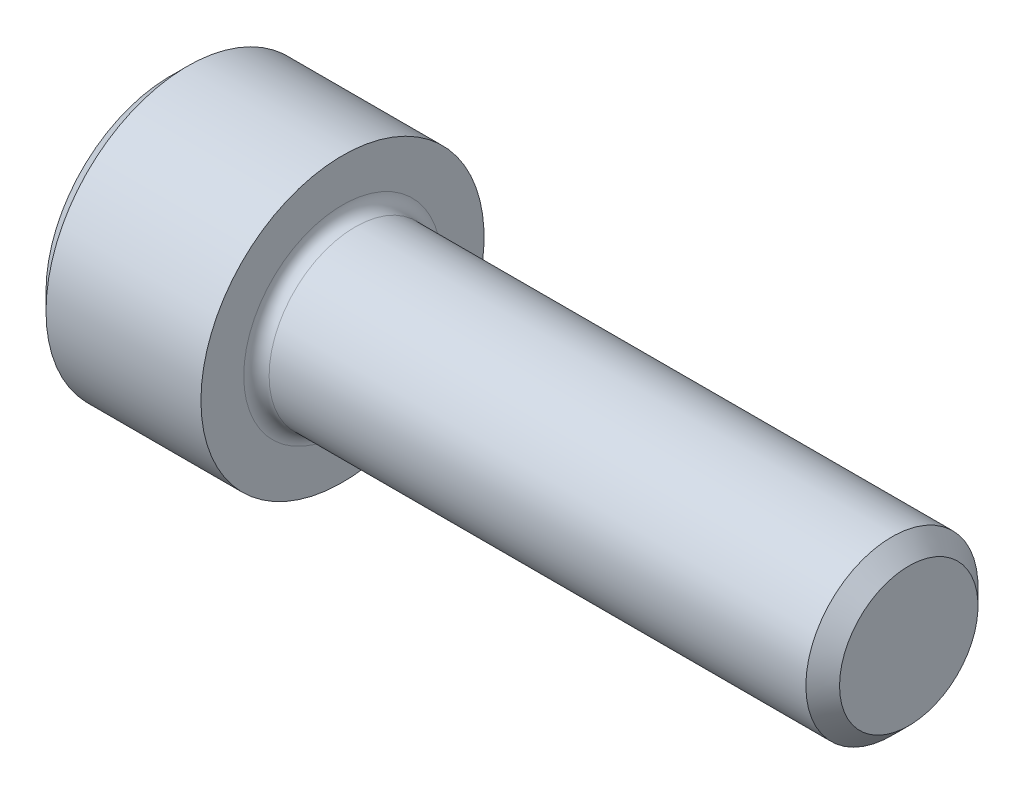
SolidWorks part; units mm, degrees
ref_plane "Plane1" through (0, 0, 0) normal (0, 0, 1) x (1, 0, 0)
ref_plane "Plane2" through (0, 0, 0) normal (0, 1, 0) x (1, 0, 0)
ref_plane "Plane3" through (0, 0, 0) normal (1, 0, 0) x (0, 0, -1)
revolve "Base-Revolve" add sketch "BodySke"
sketch "BodySke" plane through (0, 0, 0) normal (0, 0, 1) x (1, 0, 0)
  line L0 (0, 0) -> (0, 3.4862)
  line L1 (0.4826, 3.9687) -> (4.826, 3.9687)
  line L2 (4.826, 3.9687) -> (4.826, 2.413)
  line L3 (4.826, 2.413) -> (20.2286, 2.413)
  line L4 (20.701, 1.9406) -> (20.701, 0)
  line L5 (20.701, 0) -> (0, 0)
  line L6 (-31.75, 0) -> (127, 0) construction
  line L7 (0, 3.4862) -> (0.4826, 3.9687)
  line L8 (20.701, 1.9406) -> (20.2286, 2.413)
  line L9 (0, -3.4862) -> (0.4826, -3.9688) construction
  line L10 (20.701, -1.9406) -> (20.2286, -2.413) construction
  line L11 (5.6185, 9.525) -> (5.6185, 3.175) construction
  line L12 (4.826, 9.525) -> (4.826, 3.175) construction
  line L13 (-17.399, 9.525) -> (-17.399, 3.175) construction
  dimension "Diameter" = 4.826
  dimension "Head_ht" = 4.826
  dimension "Length" = 15.875
  dimension "Body_ch_ang" = 45
  dimension "Head_dia" = 7.9375
  dimension "Head_ch_ang" = 45
  dimension "Head_side_ht" = 4.3434
  dimension "Minor_dia" = 3.8811
  dimension "Advance" = 0.7925
  dimension "Thread_nom" = 15.875
  dimension "Thread_length" = 38.1
fillet "Fillet1" radius 0.3556 1 edges at (4.826, 0, 2.413)
sketch "Sketch2" plane through (0, 0, 0) normal (0, 0, 1) x (1, 0, 0)
  line L0 (0, 1.985) -> (2.286, 1.985)
  line L1 (2.286, 1.985) -> (3.432, 0)
  line L2 (-31.75, 0) -> (127, 0) construction
  line L3 (3.432, 0) -> (0, 0)
  line L4 (0, 0) -> (0, 1.985)
  line L5 (0, 3.4862) -> (0, -3.4862) construction
  line L6 (0, 0) -> (47.625, 0) construction
  line L7 (4.826, -3.9687) -> (4.826, 3.9687) construction
  dimension "D1" = 1.985
  dimension "D2" = 60
  dimension "Wall_thickness" = 2.54
revolve "Hex-PreBroach" cut sketch "Sketch2" angle 360 about L6
sketch "Sketch3" plane through (0, 0, 0) normal (-1, 0, 0) x (0, 0.5, 0.866)
  line L0 (1.146, 1.985) -> (-1.146, 1.985)
  line L1 (-1.146, 1.985) -> (-2.2921, 0)
  line L2 (1.146, 1.985) -> (2.2921, 0)
  line L3 (1.146, -1.985) -> (2.2921, 0)
  line L4 (1.146, -1.985) -> (-1.146, -1.985)
  line L5 (-1.146, -1.985) -> (-2.2921, 0)
  dimension "D1" = 1.985
  dimension "D2" = 1.985
  dimension "Hex_size" = 3.97
extrude "Hex" cut sketch "Sketch3" against normal blind 2.286
sketch "Sketch4" plane through (0, 0, 0) normal (-1, 0, 0) x (0, 0, 1)
  line L0 (0, 0) -> (2.3876, 0)
  line L1 (0, 0) -> (6.1484, 3.5498) construction
  line L2 (0, 0) -> (1.1938, 2.0677)
  line L3 (1.9883, 0.576) -> (2.2704, 0.7389)
  line L4 (1.493, 1.4339) -> (1.7751, 1.5968)
  arc A0 (1.9883, 0.576) -> (1.493, 1.4339) centre (0, 0) ccw
  arc A1 (2.3876, 0) -> (2.2704, 0.7389) centre (0, 0) ccw
  arc A2 (1.1938, 2.0677) -> (1.7751, 1.5968) centre (0, 0) cw
  dimension "D1" = 30
  dimension "Spline_n_dim" = 4.1402
  dimension "Spline_m_dim" = 4.7752
  dimension "D2" = 60
  dimension "D3" = 0.4953
  dimension "Spline_p_dim" = 0.9906
extrude "Spline" [suppressed] cut sketch "Sketch4" against normal blind 2.286
pattern_circular "CirPattern1" [suppressed] count 6 every 60
sketch "Sketch5" plane through (0, 0, 0) normal (0, 0, 1) x (1, 0, 0)
  line L0 (-31.75, 0) -> (127, 0) construction
  line L2 (0, 3.4862) -> (0, -3.4862) construction
  circle A0 centre (1.651, 0) radius 0.5905
  dimension "Drilled_hole_dia" = 1.1811
  dimension "Drilled_hole_loc" = 1.651
extrude "Hole" [suppressed] cut sketch "Sketch5" against normal through all and the other way through all
pattern_circular "Drilled-4" [suppressed] count 2 every 60
pattern_circular "Drilled-6" [suppressed] count 3 every 60
sketch "ThdSchSke" plane through (0, 0, 0) normal (0, 0, 1) x (1, 0, 0)
  line L0 (5.6185, -1.9406) -> (5.2877, -2.413)
  line L1 (5.6185, -1.9406) -> (5.9493, -2.413)
  line L2 (5.9493, -2.413) -> (5.9493, -3.0163)
  line L3 (-3.175, 0) -> (5.1513, 0) construction
  line L5 (5.9493, -3.0163) -> (5.2877, -3.0163)
  line L6 (5.2877, -3.0163) -> (5.2877, -2.413)
  line L7 (0, 3.4862) -> (0, -3.4862) construction
  dimension "Thread_minor" = 3.8811
  dimension "Diameter" = 4.826
  dimension "Start" = 5.6185
  dimension "SideAngle" = 55
  dimension "VeeAngle" = 70
  dimension "Overcut" = 6.0325
revolve "ThreadSchematic" [suppressed] cut sketch "ThdSchSke" angle 360 about L3
pattern_linear "ThdSchPat" [suppressed]
equation "\"D2@Sketch3\" = \"Hex_size@Sketch3\" / 2"
equation "\"D1@Sketch3\" = \"Hex_size@Sketch3\" / 2"
equation "\"D1@Sketch2\" = \"Hex_size@Sketch3\" / 2"
equation "\"D3@Sketch4\" = \"Spline_p_dim@Sketch4\" / 2"
equation "\"Thread_minor@ThreadCosmetic\"  =  \"Minor_dia@BodySke\""
equation "\"D2@CirPattern1\" = 360 / \"Num_teeth@CirPattern1\""
equation "\"Wall_thickness@Sketch2\" = \"Head_ht@BodySke\" - \"Key_eng@Hex\""
equation "\"Thread_length@ThreadCosmetic\" = ((sgn( (\"Length@BodySke\" - \"Advance@BodySke\" ) - \"Thread_nom@BodySke\" )-1)*( (\"Length@BodySke\" - \"Advance@BodySke\" ) - \"Thread_nom@BodySke\" ))/-2+ \"Thread_nom@BodySke\""
equation "\"Thread_minor@ThdSchSke\" = \"Minor_dia@BodySke\""
equation "\"Diameter@ThdSchSke\" = \"Diameter@BodySke\""
equation "\"Overcut@ThdSchSke\" = \"Diameter@BodySke\" * 1.25"
equation "\"Start@ThdSchSke\" = \"Head_ht@BodySke\" + \"Length@BodySke\" - \"Thread_length@ThreadCosmetic\"  '---Non-countersunk---"
equation "\"Num_threads@ThdSchPat\" = int( \"Thread_length@ThreadCosmetic\" / \"Advance@BodySke\" + 0.999 )  + 1"
equation "\"Advance@ThdSchPat\" = \"Thread_length@ThreadCosmetic\" /  (\"Num_threads@ThdSchPat\" - 1) 'relax it"
equation "\"Num_threads@ThdSchPat\" = \"Num_threads@ThdSchPat\" - sgn( \"Num_threads@ThdSchPat\" - 1) '---chamfered tips only---"
